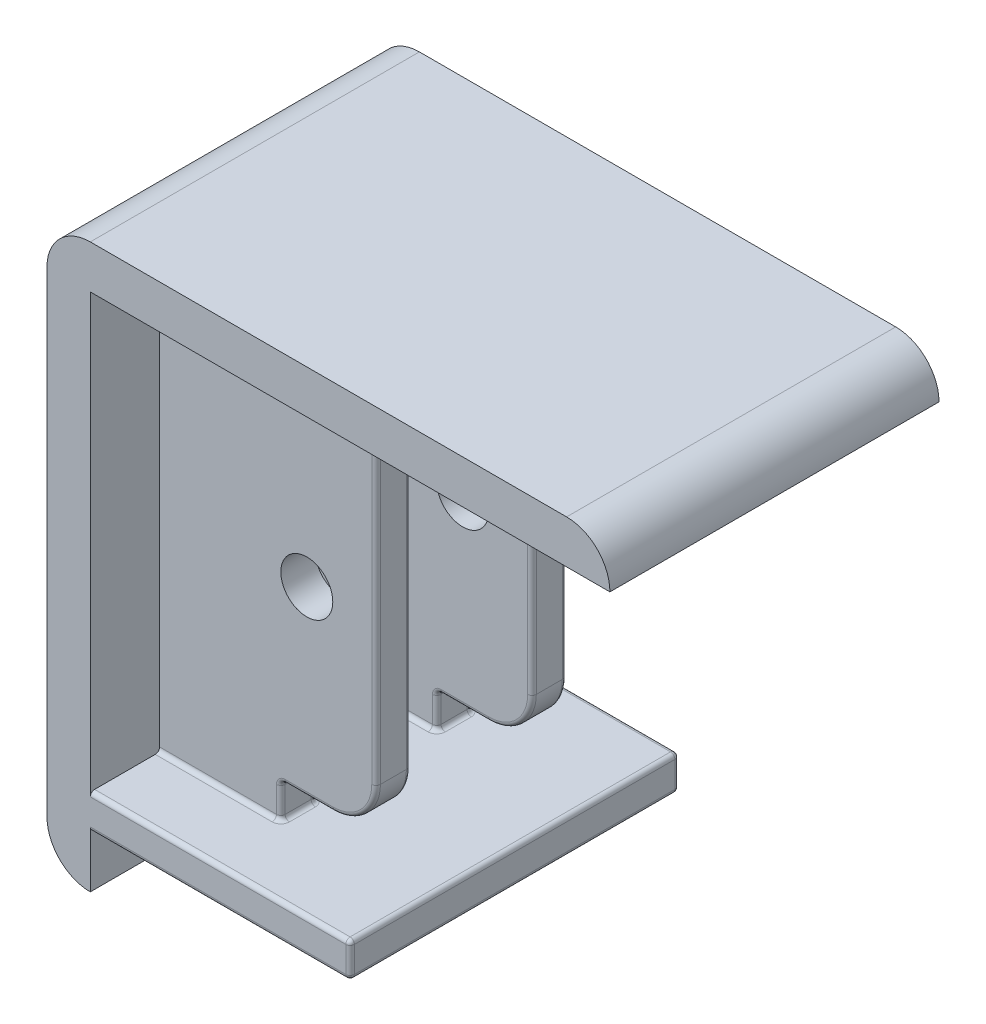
SolidWorks part; units mm, degrees
ref_plane "Plan1" through (0, 0, 0) normal (0, 0, 1) x (1, 0, 0)
ref_plane "Plan2" through (0, 0, 0) normal (0, 1, 0) x (1, 0, 0)
ref_plane "Plan3" through (0, 0, 0) normal (1, 0, 0) x (0, 0, -1)
sketch "Esquisse1" plane through (0, 0, 0) normal (0, 0, 1) x (1, 0, 0)
  line L0 (0, 0) -> (32.5, 0)
  line L1 (0, 0) -> (0, -32.5)
  line L2 (2.5, -2.5) -> (32.5, -2.5)
  line L3 (2.5, -2.5) -> (2.5, -32.5)
  line L4 (32.5, -2.5) -> (32.5, 0)
  line L5 (2.5, -32.5) -> (0, -32.5)
  dimension "D1" = 32.5
  dimension "D2" = 32.5
  dimension "D3" = 2.5
  dimension "D4" = 2.5
extrude "Base-Extrusion" add sketch "Esquisse1" along normal blind 19
fillet "Congé1" radius 2.5
fillet "Congé2" radius 2.5
fillet "Congé3" radius 2.5
sketch "Esquisse2" plane through (0, -2.5, 0) normal (0, -1, 0) x (1, 0, 0)
  line L0 (2.5, 15) -> (15, 15)
  line L1 (2.5, 19) -> (2.5, 0) construction
  line L3 (2.5, 13) -> (15, 13)
  line L4 (2.5, 6) -> (15, 6)
  line L5 (2.5, 4) -> (15, 4)
  line L6 (15, 15) -> (15, 13)
  line L7 (2.5, 15) -> (2.5, 13)
  line L8 (2.5, 6) -> (2.5, 4)
  line L11 (15, 6) -> (15, 4)
  dimension "D1" = 12.5
extrude "Boss.-Extru.1" add sketch "Esquisse2" along normal blind 23
fillet "Congé4" radius 2.5
fillet "Congé5" radius 2.5
sketch "Esquisse3" [suppressed] plane through (0, -25.5, 0) normal (0, -1, 0) x (1, 0, 0)
  line L0 (2.5, 14.9422) -> (9.4954, 14.9678)
  line L1 (2.5, 19) -> (2.5, 0) construction
  line L3 (2.5, 12.9422) -> (9.4954, 12.9678)
  line L5 (2.5, 6) -> (9.4954, 6)
  line L6 (2.5, 4) -> (9.4954, 4)
  line L7 (9.4954, 14.9678) -> (9.4954, 12.9678)
  line L9 (2.5, 14.9422) -> (2.5, 12.9422)
  line L10 (2.5, 6) -> (2.5, 4)
  line L11 (9.4954, 6) -> (9.4954, 4)
  dimension "D1" = 2
  dimension "D2" = 2
extrude "Boss.-Extru.2" [suppressed] add sketch "Esquisse3" along normal blind 2
sketch "Esquisse4" plane through (0, -25.5, 0) normal (0, -1, 0) x (1, 0, 0)
  line L0 (2.5, 4) -> (9.5, 4)
  line L1 (2.5, 19) -> (2.5, 0) construction
  line L3 (2.5, 6) -> (9.5, 6)
  line L5 (2.5, 6) -> (2.5, 4)
  line L6 (2.5, 13) -> (9.5, 13)
  line L7 (2.5, 15) -> (9.5, 15)
  line L8 (12.5, 15) -> (2.5, 15) construction
  line L9 (2.5, 15) -> (2.5, 13)
  line L10 (9.5, 15) -> (9.5, 13)
  line L11 (9.5, 6) -> (9.5, 4)
extrude "Boss.-Extru.3" add sketch "Esquisse4" along normal blind 2
sketch "Esquisse5" plane through (0, -27.5, 0) normal (0, -1, 0) x (1, 0, 0)
  line L1 (2.5, 19) -> (17.5, 19)
  line L2 (2.5, 19) -> (2.5, 0)
  line L3 (2.5, 0) -> (17.5, 0)
  line L4 (17.5, 19) -> (17.5, 0)
  dimension "D1" = 15
extrude "Boss.-Extru.4" add sketch "Esquisse5" along normal blind 2
sketch "Esquisse6" plane through (0, 0, 15) normal (0, 0, 1) x (1, 0, 0)
  line L0 (15, -23) -> (15, -2.5) construction
  line L1 (2.5, -2.5) -> (32.5, -2.5) construction
  circle A0 centre (11, -15) radius 1.5
  dimension "D1" = 3
  dimension "D2" = 4
  dimension "D3" = 12.5
extrude "Enlèv. mat.-Extru.1" cut sketch "Esquisse6" against normal blind 12
fillet "Congé7" radius 0.25
fillet "Congé8" radius 0.25
fillet "Congé9" radius 0.25
fillet "Congé10" radius 0.25
